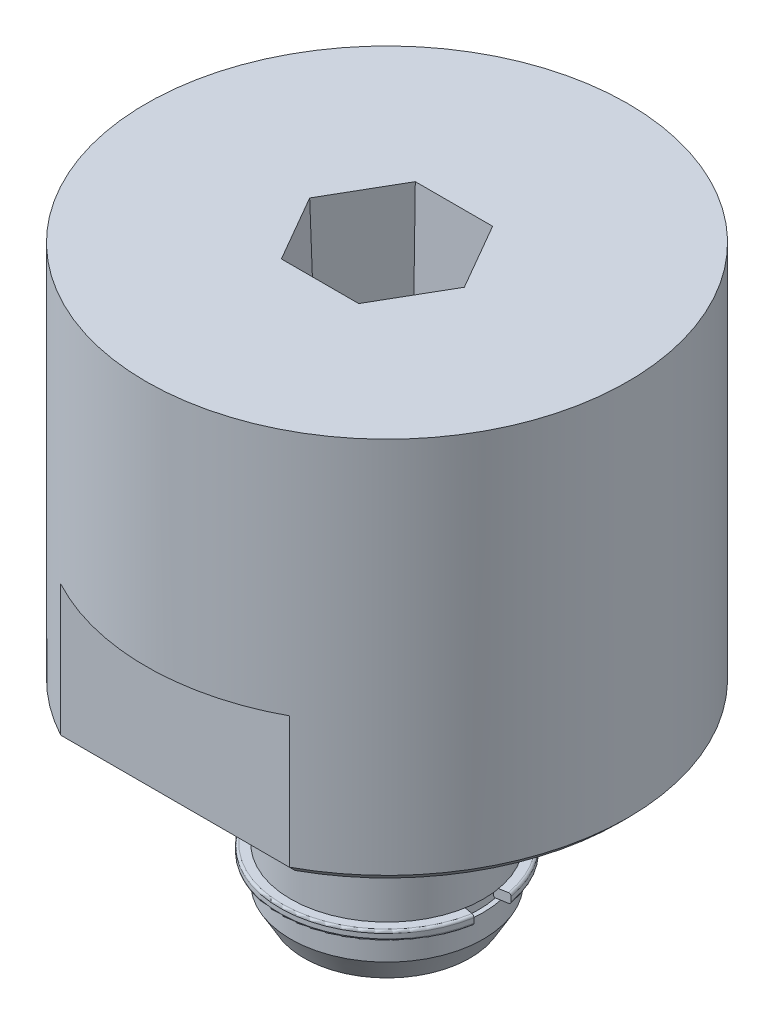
SolidWorks part; units mm, degrees
ref_plane "Front Plane" through (0, 0, 0) normal (0, 0, 1) x (1, 0, 0)
ref_plane "Top Plane" through (0, 0, 0) normal (0, 1, 0) x (1, 0, 0)
ref_plane "Right Plane" through (0, 0, 0) normal (1, 0, 0) x (0, 0, -1)
sketch "Sketch1" plane through (0, 0, 0) normal (0, 0, 1) x (1, 0, 0)
  line L0 (0, 0) -> (0, 19.05) construction
  line L1 (0, 0) -> (2.7351, 0)
  line L3 (3.683, 6.35) -> (7.935, 6.35)
  line L4 (7.935, 6.35) -> (7.935, 19.05)
  line L5 (7.935, 19.05) -> (0, 19.05)
  line L6 (0, 19.05) -> (0, 0)
  line L9 (3.175, 1.905) -> (3.0226, 1.905)
  line L10 (3.0226, 1.905) -> (3.0226, 1.524)
  line L11 (3.0226, 1.524) -> (3.175, 1.524)
  line L12 (3.175, 1.905) -> (3.175, 5.842)
  line L15 (3.175, 1.524) -> (3.175, 0.762)
  line L17 (3.175, 0.762) -> (2.7351, 0)
  arc A0 (3.175, 5.842) -> (3.683, 6.35) centre (3.683, 5.842) cw
  point P7 (0, 0)
  point P21 (3.175, 0)
  dimension "D12" = 0.508
  dimension "D2" = 6.0452
  dimension "D3" = 4.445
  dimension "D4" = 0.381
  dimension "D5" = 6.35
  dimension "D7" = 0.762
  dimension "D6" = 12.7
  dimension "D9" = 30
  dimension "D11" = 15.8699
  dimension "D8" = 6.35
revolve "Revolve1" add sketch "Sketch1" angle 360 about L0
sketch "Sketch2" plane through (0, 6.35, 0) normal (0, -1, 0) x (1, 0, 0)
  line L0 (-3.7648, 6.985) -> (3.7648, 6.985)
  line L1 (-3.7648, -6.985) -> (3.7648, -6.985)
  line L2 (-7.935, 0) -> (7.935, 0) construction
  arc A0 (-3.7648, -6.985) -> (3.7648, -6.985) centre (0, 0) ccw
  circle A1 centre (0, 0) radius 7.935 construction
  arc A2 (3.7648, 6.985) -> (-3.7648, 6.985) centre (0, 0) ccw
  circle A3 centre (0, 0) radius 7.935 construction
  dimension "D1" = 13.97
extrude "Cut-Extrude1" cut sketch "Sketch2" against normal blind 4.572
sketch "Sketch5" plane through (0, 19.05, 0) normal (0, 1, 0) x (1, 0, 0)
  line L0 (-8.7285, 0) -> (8.7285, 0) construction
  line L1 (1.1457, 1.9844) -> (-1.1457, 1.9844)
  line L2 (-1.1457, 1.9844) -> (-2.2914, 0)
  line L3 (-2.2914, 0) -> (-1.1457, -1.9844)
  line L4 (-1.1457, -1.9844) -> (1.1457, -1.9844)
  line L5 (1.1457, -1.9844) -> (2.2914, 0)
  line L6 (2.2914, 0) -> (1.1457, 1.9844)
  circle A0 centre (0, 0) radius 1.9844 construction
  dimension "D1" = 3.9688
extrude "Cut-Extrude3" cut sketch "Sketch5" against normal blind 6.35
ref_plane "Plane1" through (0, 0, 0) normal (0.7071, 0, 0.7071) x (0.7071, 0, -0.7071)
sketch "Sketch3" plane through (0, 0, 0) normal (0.7071, 0, 0.7071) x (0.7071, 0, -0.7071)
  line L0 (5.715, 5.842) -> (5.715, 6.604) construction
  line L3 (6.283, 6.35) -> (5.715, 6.35)
  line L4 (-2.2771, 6.35) -> (7.935, 6.35) construction
  line L5 (5.715, 6.35) -> (5.715, 6.604)
  arc A0 (6.283, 6.35) -> (5.715, 6.604) centre (5.715, 5.842) ccw
  dimension "D2" = 0.762
  dimension "D1" = 5.715
  dimension "D3" = 0.254
revolve "Cut-Revolve1" cut sketch "Sketch3" angle 360 about L0
pattern_circular "CirPattern1" count 8 over 360 about axis through (0, 0, 0) along (0, 1, 0) of "Cut-Revolve1"
chamfer "Chamfer1" distance 0.254 angle 45 4 edges at (0, 6.35, -6.985) (-7.935, 6.35, 0) (7.935, 6.35, 0) (0, 6.35, 6.985)
draft "Draft3" type of draft neutral plane draft angle 2 faces to draft 6 parameters "D1"=2
sketch "Sketch7" plane through (0, 0, 0) normal (0, 0, 1) x (1, 0, 0)
  line L0 (-2.8379, 19.05) -> (2.8379, 19.05)
  line L1 (2.8379, 19.05) -> (2.3451, 16.2553)
  line L3 (-2.3451, 16.2553) -> (-2.8379, 19.05)
  line L4 (7.935, 19.05) -> (-7.935, 19.05) construction
  line L5 (0, 12.7) -> (0, 19.05) construction
  arc A0 (-2.3451, 16.2553) -> (2.3451, 16.2553) centre (0, 16.6687) ccw
  dimension "D1" = 4.7625
  dimension "D2" = 10
extrude "Cut-Extrude4" [suppressed] cut sketch "Sketch7" against normal mid plane 19.05
sketch "Sketch8" plane through (0, 12.7, 0) normal (0, 1, 0) x (1, 0, 0)
  circle A0 centre (0, 0) radius 1.5875
  dimension "D1" = 3.175
extrude "Cut-Extrude5" cut sketch "Sketch8" against normal through all
chamfer "Chamfer2" distance 0.508 angle 45 1 edges at (0, 0, 1.5875)
imported_body "VS-25.sldprt"
move or copy body "Body-Move/Copy2" bodies to move or copy 135 placed by mates yes parameters "D1"=0, "D2"=0, "D3"=0
